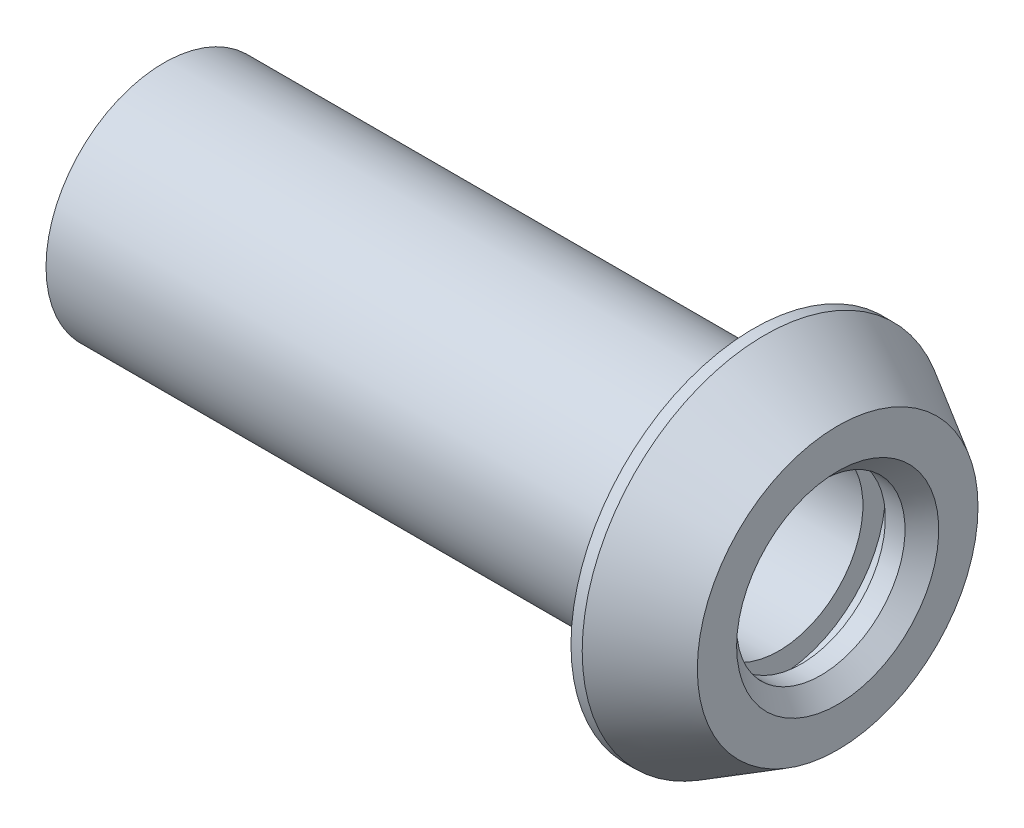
SolidWorks part; units mm, degrees
ref_plane "Face" through (0, 0, 0) normal (0, 0, 1) x (1, 0, 0)
ref_plane "Dessus" through (0, 0, 0) normal (0, 1, 0) x (1, 0, 0)
ref_plane "Droite" through (0, 0, 0) normal (1, 0, 0) x (0, 0, -1)
sketch "Esquisse1" plane through (0, 0, 0) normal (0, 0, 1) x (1, 0, 0)
  line L0 (-106.9854, 0) -> (119.0692, 0) construction
  line L1 (0, 21) -> (0, 32.5)
  line L2 (0, 32.5) -> (2, 32.5)
  line L3 (2, 32.5) -> (15, 24.9944)
  line L4 (15, 24.9944) -> (15, 18)
  line L5 (12, 15) -> (8.5, 15)
  line L6 (8.5, 15) -> (8.5, 19)
  line L7 (8.5, 19) -> (4.5, 19)
  line L8 (4.5, 19) -> (4.5, 15)
  line L9 (4.5, 15) -> (-18, 15)
  line L10 (-18, 15) -> (-18, 15.75)
  line L11 (-18, 15.75) -> (-105, 15.75)
  line L12 (-105, 15.75) -> (-105, 21)
  line L13 (-105, 21) -> (0, 21)
  line L14 (15, 18) -> (12, 15)
  point P7 (15, 15)
  dimension "D1" = 15
  dimension "D2" = 2
  dimension "D3" = 30
  dimension "D4" = 42
  dimension "D5" = 65
  dimension "D6" = 30
  dimension "D7" = 31.5
  dimension "D8" = 3.5
  dimension "D9" = 4
  dimension "D11" = 30
  dimension "D12" = 105
revolve "Révolution1" add sketch "Esquisse1" angle 360 about L0
